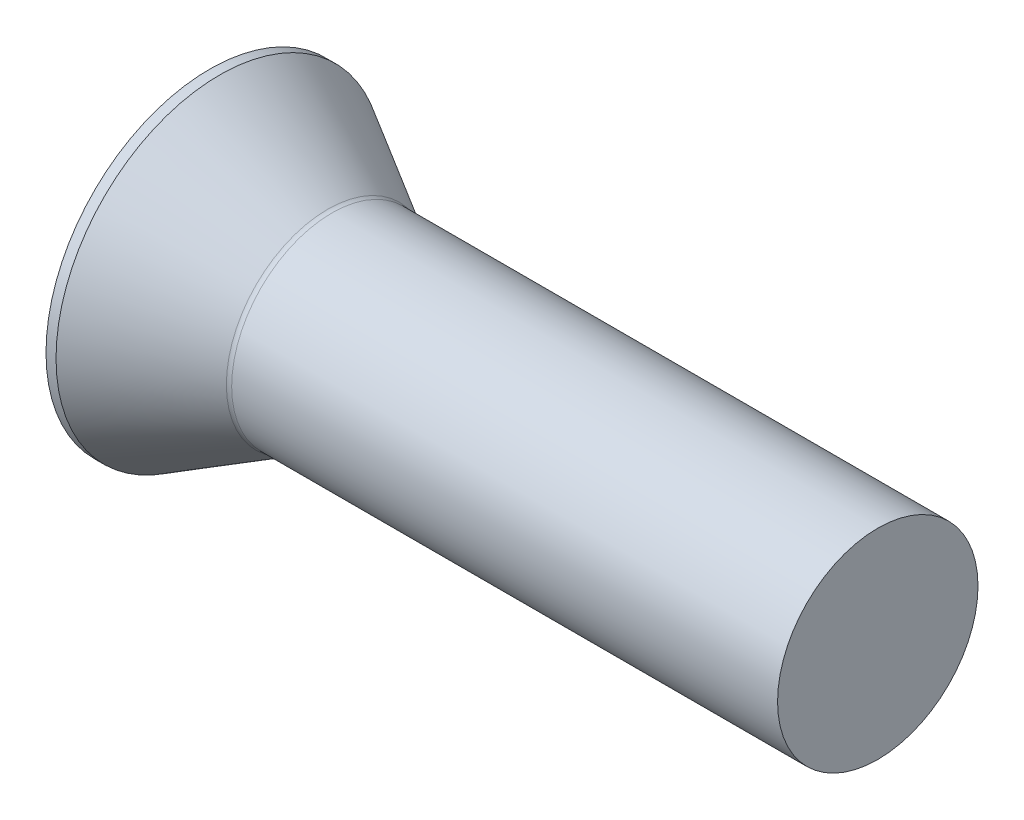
SolidWorks part; units mm, degrees
ref_plane "Front" through (0, 0, 0) normal (0, 0, 1) x (1, 0, 0)
ref_plane "Top" through (0, 0, 0) normal (0, 1, 0) x (1, 0, 0)
ref_plane "Right" through (0, 0, 0) normal (1, 0, 0) x (0, 0, -1)
other "Configuration Table"
sketch "Sketch1" plane through (0, 0, 0) normal (0, 0, 1) x (0, 1, 0)
  line L0 (0, 0) -> (9.8, 0)
  line L1 (9.8, 0) -> (9.8, -0.6)
  line L2 (9.8, -0.6) -> (6, -7.1818)
  line L3 (6, -7.1818) -> (6, -40)
  line L4 (6, -40) -> (0, -40)
  line L5 (0, -40) -> (0, 0)
  line L6 (0, 2.03) -> (0, -4.03) construction
  dimension "b" = 0.6
  dimension "dk" = 19.6
  dimension "l" = 40
  dimension "d" = 12
  dimension "a" = 30
revolve "Base-Revolve" add sketch "Sketch1" angle 360 about L6
fillet "Fillet1" radius 0.5 1 edges at (7.1818, 0, 6)
